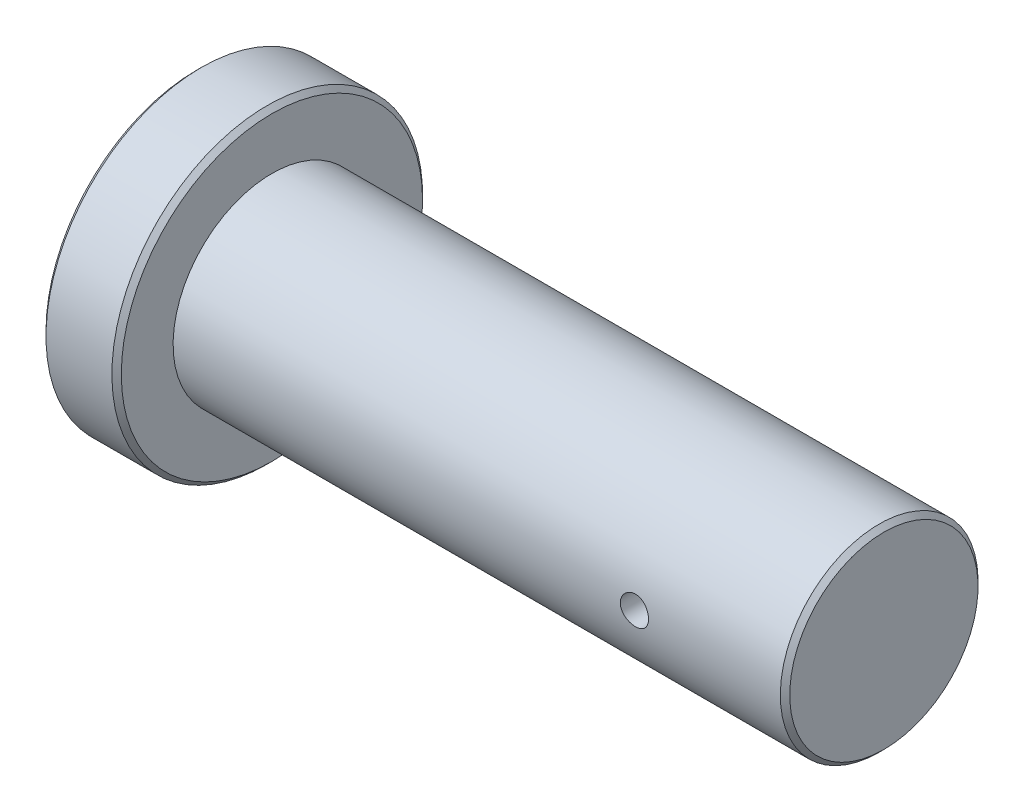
SolidWorks part; units mm, degrees
ref_plane "Front Plane" through (0, 0, 0) normal (0, 0, 1) x (1, 0, 0)
ref_plane "Top Plane" through (0, 0, 0) normal (0, 1, 0) x (1, 0, 0)
ref_plane "Right Plane" through (0, 0, 0) normal (1, 0, 0) x (0, 0, -1)
sketch "Sketch2" plane through (0, 0, 0) normal (0, 0, 1) x (1, 0, 0)
  line L0 (0, 0) -> (0, 16.5)
  line L1 (0, 16.5) -> (8, 16.5)
  line L2 (8, 16.5) -> (8, 10.5)
  line L3 (8, 10.5) -> (73, 10.5)
  line L4 (73, 10.5) -> (73, 0)
  line L5 (73, 0) -> (0, 0)
  line L6 (0, 0) -> (73, 0) construction
  dimension "D1" = 10.5
  dimension "D2" = 8
  dimension "D3" = 65
  dimension "D4" = 6
revolve "Revolve1" add sketch "Sketch2" angle 360 about L6
sketch "Sketch3" plane through (0, 0, 0) normal (0, 0, 1) x (1, 0, 0)
  line L0 (73, -10.5) -> (73, 10.5) construction
  circle A0 centre (57, 0) radius 1.5
  dimension "D1" = 16
  dimension "D2" = 3
extrude "Cut-Extrude1" cut sketch "Sketch3" against normal mid plane 40
chamfer "Chamfer1" distance 0.5 angle 45 3 edges at (73, -10.5, 0) (8, -16.5, 0) (0, -16.5, 0)
scale "Scale1" scale about centroid uniform scaling yes scale factor 0.7
scale "Scale2" scale about centroid uniform scaling yes scale factor 0.5
scale "Scale3" scale about centroid uniform scaling yes scale factor 1.25
